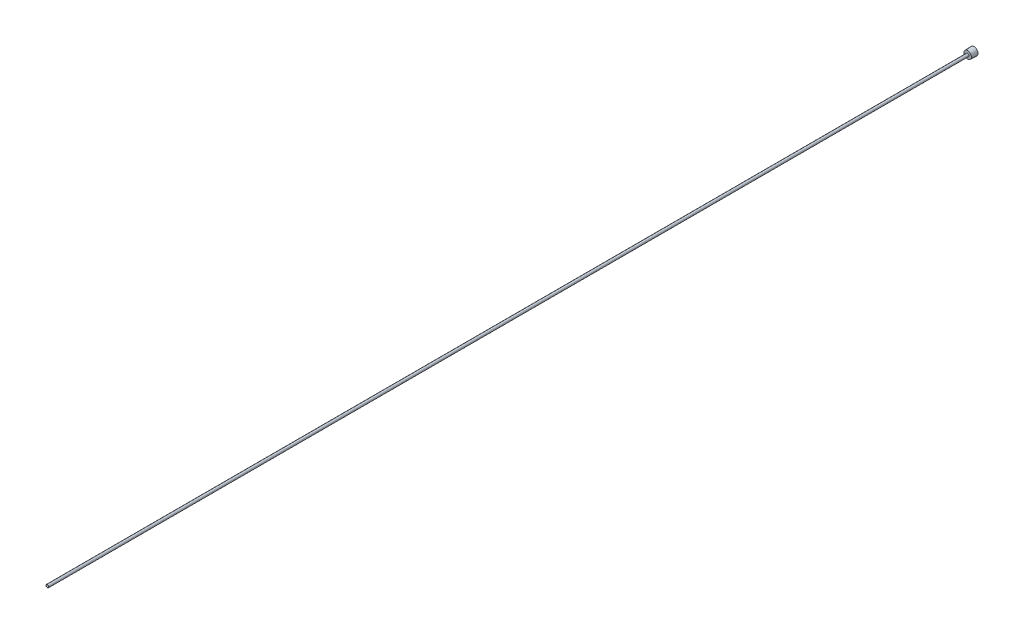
SolidWorks part; units mm, degrees
ref_plane "Front Plane" through (0, 0, 0) normal (0, 0, 1) x (1, 0, 0)
ref_plane "Top Plane" through (0, 0, 0) normal (0, 1, 0) x (1, 0, 0)
ref_plane "Right Plane" through (0, 0, 0) normal (1, 0, 0) x (0, 0, -1)
sketch "Sketch1" plane through (0, 0, 0) normal (1, 0, 0) x (0, 0, -1)
  line L0 (-914.4, 0) -> (0, 0)
  line L5 (0, 3.8989) -> (-6.35, 3.6674)
  line L6 (0, 0) -> (0, 3.8989)
  line L7 (-6.35, 3.6674) -> (-6.35, 1.3891)
  line L8 (-6.35, 1.3891) -> (-914.4, 1.3891)
  line L9 (-914.4, 1.3891) -> (-914.4, 0)
  line L10 (0, 0) -> (49989.3417, 0) construction
  dimension "D1" = 2.088
  dimension "D2" = 6.35
  dimension "D3" = 914.4
  dimension "D4" = 2.7781
  dimension "D5" = 7.7978
revolve "Revolve1" add sketch "Sketch1" angle 360 about L10
sketch "Sketch2" plane through (0, 0, 914.4) normal (0, 0, 1) x (1, 0, 0)
  circle A0 centre (0, 0) radius 1.2065
  dimension "D1" = 2.413
extrude "Cut-Extrude1" cut sketch "Sketch2" against normal through all
sketch "Sketch3" plane through (0, 0, 0) normal (0, 0, -1) x (-1, 0, 0)
  line L0 (0, 4.2888) -> (0, -4.2888) construction
  line L1 (0, -2.757) -> (2.3876, -1.3785)
  line L2 (2.3876, -1.3785) -> (2.3876, 1.3785)
  line L3 (2.3876, 1.3785) -> (0, 2.757)
  line L4 (0, 2.757) -> (-2.3876, 1.3785)
  line L5 (-2.3876, 1.3785) -> (-2.3876, -1.3785)
  line L6 (-2.3876, -1.3785) -> (0, -2.757)
  circle A0 centre (0, 0) radius 2.3876 construction
  dimension "D1" = 4.7752
extrude "Cut-Extrude2" cut sketch "Sketch3" against normal blind 3.9688
